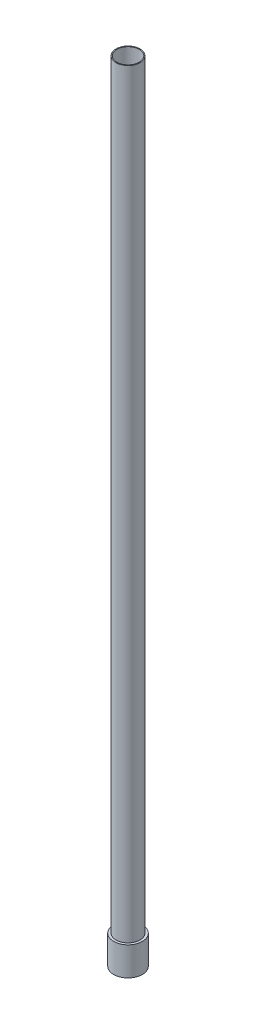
SolidWorks part; units mm, degrees
ref_plane "Front Plane" through (0, 0, 0) normal (0, 0, 1) x (1, 0, 0)
ref_plane "Top Plane" through (0, 0, 0) normal (0, 1, 0) x (1, 0, 0)
ref_plane "Right Plane" through (0, 0, 0) normal (1, 0, 0) x (0, 0, -1)
sketch "Sketch2" plane through (0, 0, 0) normal (0, 0, 1) x (1, 0, 0)
  line L0 (0, 0) -> (0, 304.8) construction
  line L1 (-4.318, 0) -> (-5.5499, 0)
  line L2 (-5.5499, 0) -> (-5.5499, 11.0998)
  line L3 (-5.5499, 11.0998) -> (-4.6355, 11.0998)
  line L4 (-4.6355, 11.0998) -> (-4.6355, 304.8)
  line L5 (-4.6355, 304.8) -> (-4.318, 304.8)
  line L6 (-4.318, 0) -> (-4.318, 304.8)
  dimension "D1" = 11.0998
  dimension "D2" = 11.0998
  dimension "D3" = 9.271
  dimension "D4" = 304.8
  dimension "D5" = 8.636
revolve "Revolve1" add sketch "Sketch2" angle 360 about L0
